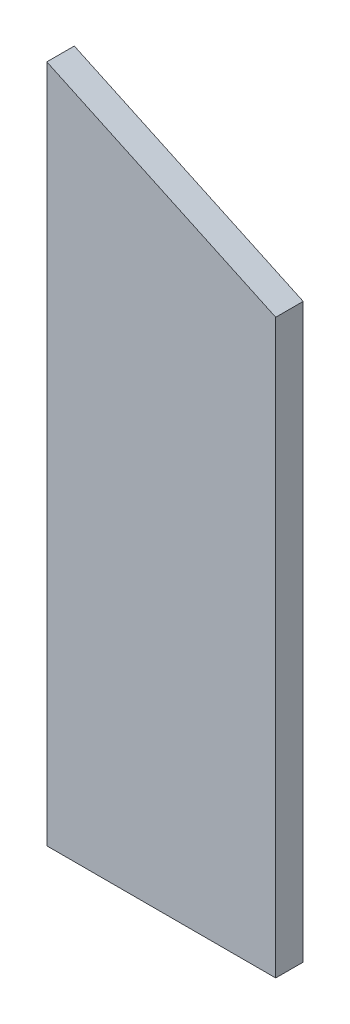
SolidWorks part; units mm, degrees
ref_plane "Plan de face" through (0, 0, 0) normal (0, 0, 1) x (1, 0, 0)
ref_plane "Plan de dessus" through (0, 0, 0) normal (0, 1, 0) x (1, 0, 0)
ref_plane "Plan de droite" through (0, 0, 0) normal (1, 0, 0) x (0, 0, -1)
sketch "Esquisse1" plane through (0, 0, 0) normal (0, 0, 1) x (1, 0, 0)
  line L0 (0, 0) -> (0, 250)
  line L1 (0, 250) -> (-100, 296.6308)
  line L2 (-100, 296.6308) -> (-100, 0)
  line L5 (-100, 0) -> (0, 0)
  line L6 (0, 250) -> (-100, 250) construction
  dimension "D1" = 250
  dimension "D2" = 100
  dimension "D3" = 25
extrude "Boss.-Extru.1" add sketch "Esquisse1" along normal blind 12
